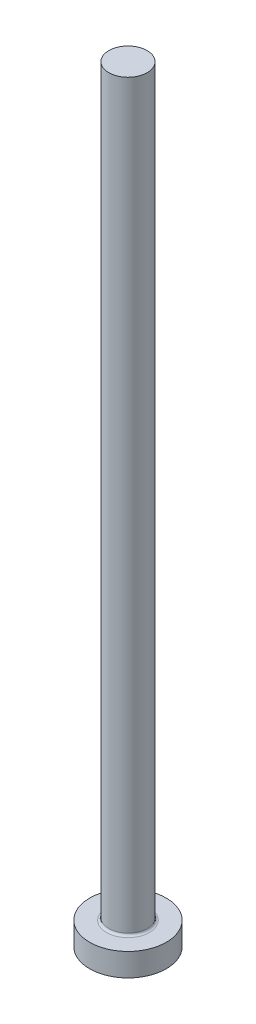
SolidWorks part; units mm, degrees
ref_plane "Plano frontal" through (0, 0, 0) normal (0, 0, 1) x (1, 0, 0)
ref_plane "Plano superior" through (0, 0, 0) normal (0, 1, 0) x (1, 0, 0)
ref_plane "Plano direito" through (0, 0, 0) normal (1, 0, 0) x (0, 0, -1)
sketch "Esboço1" plane through (0, 0, 0) normal (0, 0, 1) x (1, 0, 0)
  line L0 (0, 0) -> (5, 0)
  line L1 (5, 0) -> (5, 3)
  line L2 (5, 3) -> (2.8, 3)
  line L3 (2.5, 3.3) -> (2.5, 100)
  line L4 (2.5, 100) -> (0, 100)
  line L5 (0, 100) -> (0, 0) construction
  line L6 (0, 0) -> (0, 100)
  arc A0 (2.8, 3) -> (2.5, 3.3) centre (2.8, 3.3) cw
  dimension "D3" = 0.3
  dimension "D1" = 10
  dimension "D2" = 5
  dimension "D4" = 3
  dimension "D5" = 100
revolve "Revolução1" add sketch "Esboço1" angle 360 about L5
sketch "Esboço2"
  dimension "D1" = 0.375
  dimension "D2" = 0.875
  dimension "D3" = 0.5625
  dimension "D4" = 2.6875
wrap "Envolver1" sketch "Esboço2" wrap type deboss source sketch "Esboço2" thickness 0.1 parameters "D1"=0.1
